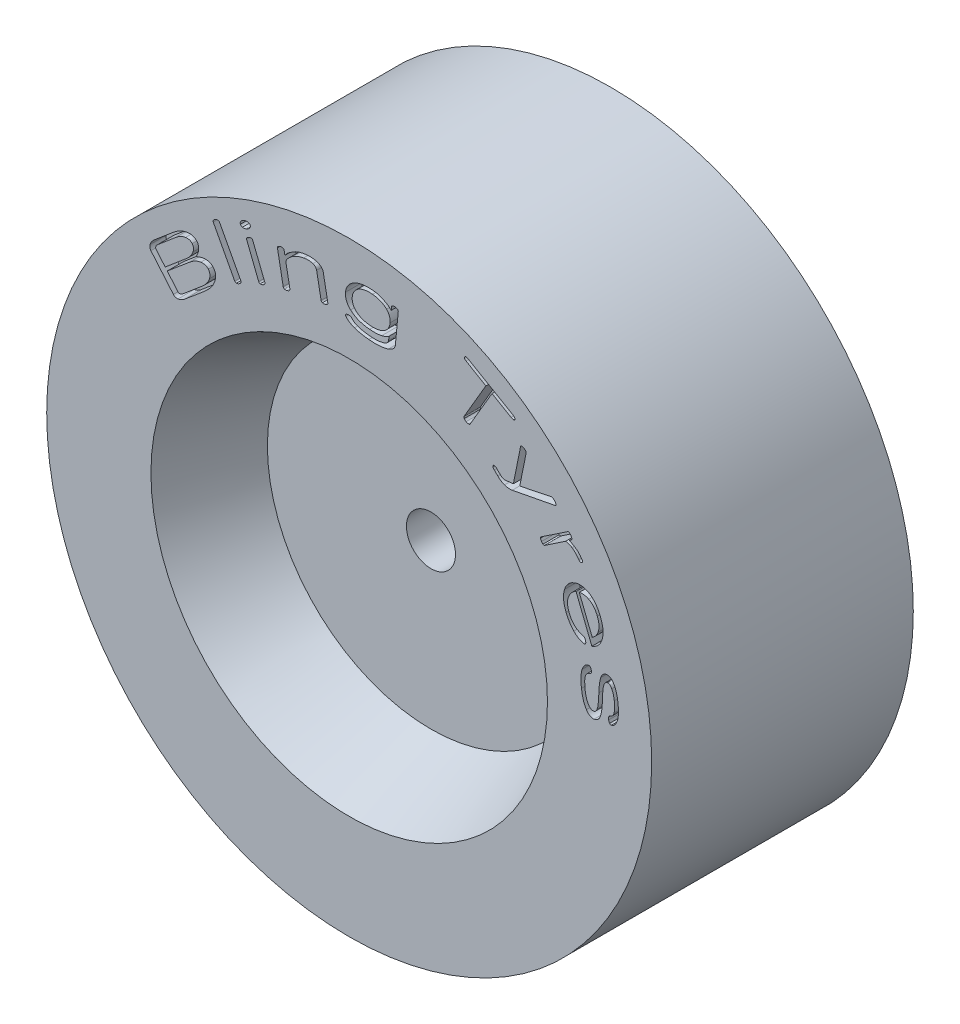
SolidWorks part; units mm, degrees
ref_plane "Front Plane" through (0, 0, 0) normal (0, 0, 1) x (1, 0, 0)
ref_plane "Top Plane" through (0, 0, 0) normal (0, 1, 0) x (1, 0, 0)
ref_plane "Right Plane" through (0, 0, 0) normal (1, 0, 0) x (0, 0, -1)
sketch "Sketch1" plane through (0, 0, 0) normal (0, 0, 1) x (1, 0, 0)
  circle A0 centre (0, 0) radius 1.5
  circle A1 centre (0, 0) radius 18.5
  dimension "D1" = 3
  dimension "D2" = 37
extrude "Extrude1" add sketch "Sketch1" along normal blind 16
sketch "Sketch2" plane through (0, 0, 16) normal (0, 0, 1) x (1, 0, 0)
  circle A0 centre (0, 0) radius 12.1257
extrude "Extrude2" cut sketch "Sketch2" against normal blind 5 draft 23
sketch "Sketch3" plane through (0, 0, 16) normal (0, 0, 1) x (1, 0, 0)
  circle A0 centre (0, 0) radius 14.5
  dimension "D1" = 29
sketch "Sketch4"
extrude "Extrude3" cut sketch "Sketch4" against normal blind 1
